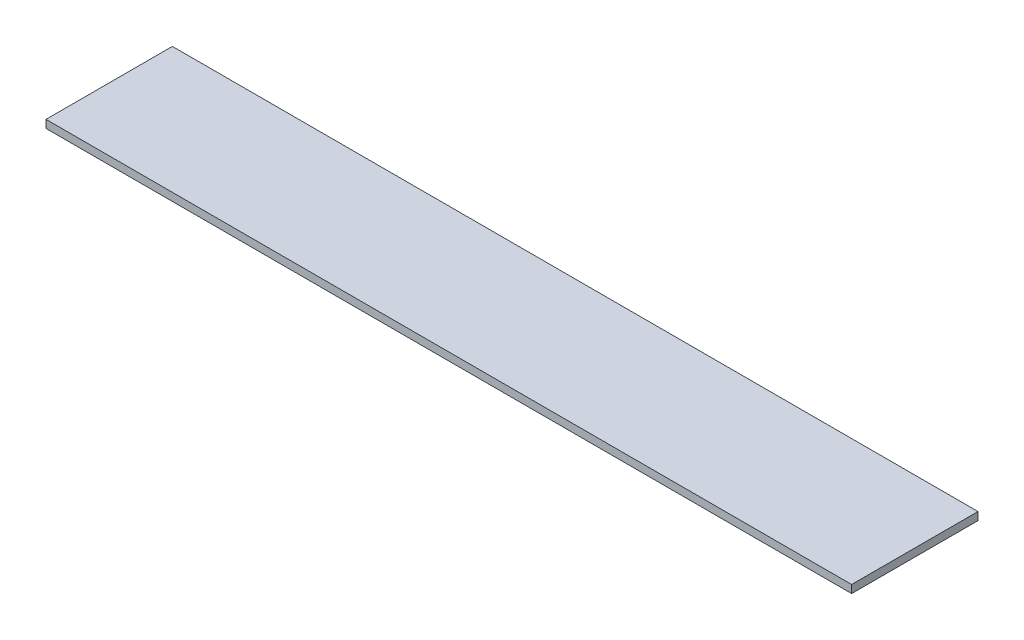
SolidWorks part; units mm, degrees
ref_plane "FRONT" through (0, 0, 0) normal (0, 0, 1) x (1, 0, 0)
ref_plane "TOP" through (0, 0, 0) normal (0, 1, 0) x (1, 0, 0)
ref_plane "RIGHT" through (0, 0, 0) normal (1, 0, 0) x (0, 0, -1)
sketch "Sketch1" plane through (0, 0, 0) normal (0, 1, 0) x (1, 0, 0)
  line L1 (-323.85, 50.8) -> (323.85, 50.8)
  line L2 (-323.85, 50.8) -> (-323.85, -50.8)
  line L3 (-323.85, -50.8) -> (323.85, -50.8)
  line L4 (323.85, 50.8) -> (323.85, -50.8)
  line L5 (-323.85, 50.8) -> (323.85, -50.8) construction
  line L6 (-323.85, -50.8) -> (323.85, 50.8) construction
  point P0 (0, 0)
  dimension "D1" = 101.6
  dimension "D2" = 647.7
extrude "Boss-Extrude1" add sketch "Sketch1" along normal blind 6.35
